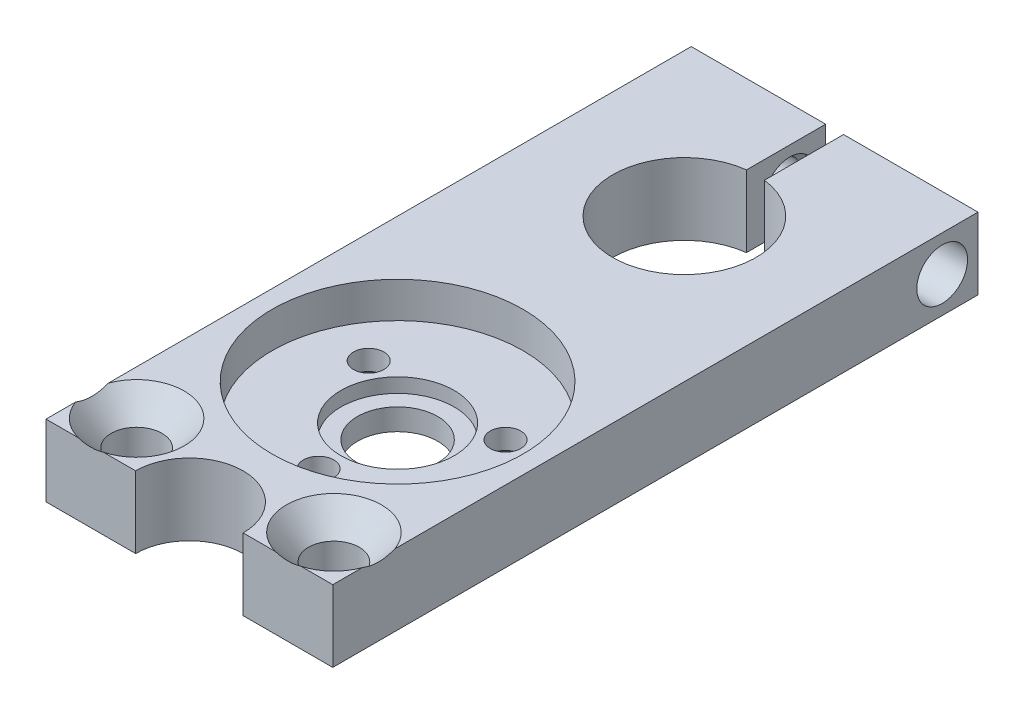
SolidWorks part; units mm, degrees
ref_plane "Front Plane" through (0, 0, 0) normal (0, 0, 1) x (1, 0, 0)
ref_plane "Top Plane" through (0, 0, 0) normal (0, 1, 0) x (1, 0, 0)
ref_plane "Right Plane" through (0, 0, 0) normal (1, 0, 0) x (0, 0, -1)
sketch "Sketch1" plane through (0, 0, 0) normal (1, 0, 0) x (0, 0, -1)
  line L1 (0, 3.175) -> (57.15, 3.175)
  line L2 (0, 3.175) -> (0, -3.175)
  line L3 (0, -3.175) -> (57.15, -3.175)
  line L4 (57.15, 3.175) -> (57.15, -3.175)
  point P4 (0, 0)
  dimension "D1" = 6.35
  dimension "D2" = 57.15
extrude "Extrude1" add sketch "Sketch1" along normal mid plane 25.4
sketch "Sketch2" plane through (0, 3.175, 0) normal (0, 1, 0) x (1, 0, 0)
  line L0 (12.7, 0) -> (-12.7, 0) construction
  circle A0 centre (0, 18.4404) radius 11.1125
  dimension "D2" = 22.225
  dimension "D1" = 18.4404
extrude "Cut-Extrude1" cut sketch "Sketch2" against normal blind 3.175
sketch "Sketch3" plane through (0, 0, 0) normal (0, 1, 0) x (1, 0, 0)
  circle A0 centre (0, 18.4404) radius 5.0165
  dimension "D1" = 10.033
extrude "Cut-Extrude2" cut sketch "Sketch3" against normal blind 1.27
sketch "Sketch4" plane through (0, -1.27, 0) normal (0, 1, 0) x (1, 0, 0)
  circle A0 centre (0, 18.4404) radius 3.556
  dimension "D1" = 7.112
extrude "Cut-Extrude3" cut sketch "Sketch4" against normal up to next
sketch "Sketch5" plane through (0, -3.175, 0) normal (0, -1, 0) x (1, 0, 0)
  circle A0 centre (0, -11.4427) radius 1.016
  circle A1 centre (0, -18.4404) radius 3.556 construction
  circle A2 centre (6.0602, -21.9393) radius 1.016
  circle A3 centre (-6.0602, -21.9392) radius 1.016
  dimension "D1" = 2.032
  dimension "D2" = 6.9977
extrude "Cut-Extrude4" cut sketch "Sketch5" against normal up to next
hole_wizard "CSK for M2.5 Flat Head Machine Screw1" positions "3DSketch1" profile "Sketch6" countersink size "M2.5" standard "Ansi Metric"
sketch3d "3DSketch1"
  line L0 (6.0602, 0, -21.9393) -> (6.0602, -3.175, -21.9393) construction
  line L1 (-6.0602, 0, -21.9392) -> (-6.0602, -3.175, -21.9392) construction
  line L2 (0, 0, -11.4427) -> (0, -3.175, -11.4427) construction
  point P0 (6.0602, -3.175, -21.9393)
  point P2 (-6.0602, -3.175, -21.9392)
  point P4 (0, -3.175, -11.4427)
sketch "Sketch6" plane through (6.0602, -3.175, -21.9393) normal (1, 0, 0) x (0, 0, -1)
  line L0 (0, 0) -> (0, 6.35)
  line L1 (0, 6.35) -> (1.35, 6.35)
  line L2 (1.35, 6.35) -> (1.35, 1.4)
  line L3 (1.35, 1.4) -> (2.75, 0)
  line L5 (2.75, 0) -> (0, 0)
  line L6 (-1.35, 1.4) -> (-2.75, 0) construction
  line L11 (0, -6.35) -> (0, 107.95) construction
  dimension "Thru Hole Dia." = 2.7
  dimension "Thru Hole Depth" = 6.35
  dimension "Near C'Sink Dia." = 5.5
  dimension "Near C'Sink Angle" = 90
sketch "Sketch7" plane through (0, 3.175, 0) normal (0, 1, 0) x (1, 0, 0)
  line L2 (12.7, 57.15) -> (-12.7, 57.15) construction
  line L3 (-0.7938, 57.15) -> (0.7937, 57.15)
  line L4 (-0.7938, 57.15) -> (-0.7937, 50.1406)
  line L6 (0.7937, 57.15) -> (0.7937, 50.1406)
  arc A0 (-0.7937, 50.1406) -> (0.7937, 50.1406) centre (0, 43.8404) ccw
  circle A1 centre (0, 18.4404) radius 3.556 construction
  point P4 (0, 57.15)
  dimension "D1" = 25.4
  dimension "D2" = 12.7
  dimension "D3" = 1.5875
extrude "Cut-Extrude5" cut sketch "Sketch7" against normal up to next
sketch "Sketch12" plane through (0, 3.175, 0) normal (0, 1, 0) x (1, 0, 0)
  circle A0 centre (0, 0) radius 4.7625
  dimension "D1" = 9.525
extrude "Cut-Extrude6" cut sketch "Sketch12" against normal up to next
hole_wizard "#8-32 Tapped Hole3" positions "3DSketch7" profile "Sketch15" tap size "#8-32" standard "Ansi Inch"
sketch3d "3DSketch7"
  point P0 (-0.7938, 0, -53.975)
  dimension "D1" = 3.175
  dimension "D2" = 3.175
sketch "Sketch15" plane through (-0.7938, 0, -53.975) normal (0, 1, 0) x (0, 0, -1)
  line L0 (0, 0) -> (0, 11.9062)
  line L1 (0, 11.9062) -> (1.7272, 11.9062)
  line L2 (1.7272, 11.9062) -> (1.7272, 0)
  line L5 (1.7272, 0) -> (0, 0)
  line L11 (0, -6.35) -> (0, 107.95) construction
  dimension "Thru Tap Drill Dia." = 3.4544
  dimension "Thru Tap Drill Depth" = 11.9062
hole_wizard "#8 Clearance Hole1" positions "3DSketch8" profile "Sketch16" hole size "#8" standard "Ansi Inch"
sketch3d "3DSketch8"
  line L0 (12.7, -3.175, -57.15) -> (12.7, 3.175, -57.15) construction
  line L1 (12.7, 3.175, -57.15) -> (12.7, 3.175, 0) construction
  point P0 (12.7, 0, -53.975)
  dimension "D1" = 3.175
  dimension "D2" = 3.175
sketch "Sketch16" plane through (12.7, 0, -53.975) normal (0, 1, 0) x (0, 0, -1)
  line L0 (0, 0) -> (0, 15.3207)
  line L1 (0, 15.3207) -> (2.2479, 13.97)
  line L2 (2.2479, 13.97) -> (2.2479, 0)
  line L5 (2.2479, 0) -> (0, 0)
  line L10 (0, 15.3207) -> (-2.2479, 13.97) construction
  line L11 (0, -6.35) -> (0, 107.95) construction
  dimension "Hole Dia." = 4.4958
  dimension "Hole Depth" = 13.97
  dimension "Drill Angle" = 118
hole_wizard "CSK for #8 Flat Head Machine Screw1" positions "3DSketch9" profile "Sketch17" countersink size "#8" standard "Ansi Inch"
sketch3d "3DSketch9"
  line L0 (-4.7625, 3.175, 0) -> (-12.7, 3.175, 0) construction
  line L1 (12.7, 3.175, 0) -> (4.7625, 3.175, 0) construction
  line L2 (12.7, 3.175, -57.15) -> (12.7, 3.175, 0) construction
  line L3 (-12.7, 3.175, -57.15) -> (-12.7, 3.175, 0) construction
  point P0 (-8.7376, 3.175, -4.064)
  point P2 (8.7376, 3.175, -4.064)
  dimension "D1" = 4.064
  dimension "D2" = 4.064
  dimension "D3" = 3.9624
  dimension "D4" = 3.9624
sketch "Sketch17" plane through (-8.7376, 3.175, -4.064) normal (1, 0, 0) x (0, 0, 1)
  line L0 (0, 0) -> (0, 6.35)
  line L1 (0, 6.35) -> (2.2479, 6.35)
  line L2 (2.2479, 6.35) -> (2.2479, 2.2645)
  line L3 (2.2479, 2.2645) -> (4.2164, 0)
  line L5 (4.2164, 0) -> (0, 0)
  line L6 (-2.2479, 2.2645) -> (-4.2164, 0) construction
  line L11 (0, -6.35) -> (0, 107.95) construction
  dimension "Thru Hole Dia." = 4.4958
  dimension "Thru Hole Depth" = 6.35
  dimension "Near C'Sink Dia." = 8.4328
  dimension "Near C'Sink Angle" = 82
